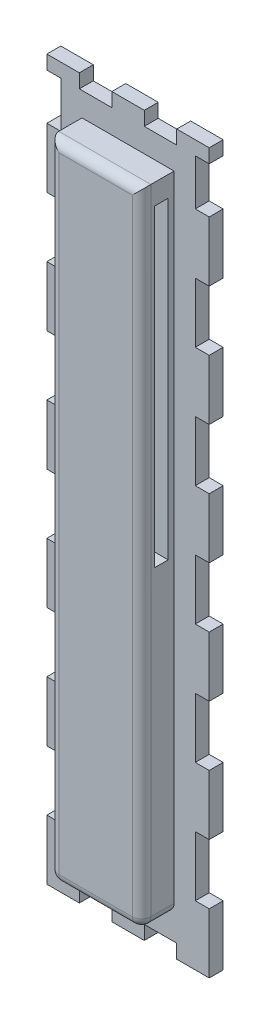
SolidWorks part; units mm, degrees
ref_plane "Front Plane" through (0, 0, 0) normal (0, 0, 1) x (1, 0, 0)
ref_plane "Top Plane" through (0, 0, 0) normal (0, 1, 0) x (1, 0, 0)
ref_plane "Right Plane" through (0, 0, 0) normal (1, 0, 0) x (0, 0, -1)
sketch "Sketch1" plane through (0, 0, 0) normal (0, 0, 1) x (1, 0, 0)
  line L0 (3.5, 74.5) -> (10.5, 74.5)
  line L1 (17.5, 77.5) -> (17.5, -77.5)
  line L2 (-17.5, 77.5) -> (-17.5, -77.5)
  line L3 (-10.5, -74.5) -> (-3.5, -74.5)
  line L4 (-3.5, -74.5) -> (-3.5, -77.5)
  line L5 (-17.5, 77.5) -> (17.5, -77.5) construction
  line L6 (-17.5, -77.5) -> (17.5, 77.5) construction
  line L9 (-17.5, 77.5) -> (-10.5, 77.5)
  line L10 (-10.5, 74.5) -> (-10.5, 77.5)
  line L11 (-3.5, 74.5) -> (-3.5, 77.5)
  line L12 (-3.5, 77.5) -> (3.5, 77.5)
  line L13 (3.5, 74.5) -> (3.5, 77.5)
  line L14 (10.5, 74.5) -> (10.5, 77.5)
  line L15 (10.5, 77.5) -> (17.5, 77.5)
  line L18 (-10.5, 74.5) -> (-3.5, 74.5)
  line L19 (-17.5, 0) -> (17.5, 0) construction
  line L21 (10.5, -77.5) -> (17.5, -77.5)
  line L22 (10.5, -74.5) -> (10.5, -77.5)
  line L23 (3.5, -74.5) -> (10.5, -74.5)
  line L24 (3.5, -74.5) -> (3.5, -77.5)
  line L25 (-3.5, -77.5) -> (3.5, -77.5)
  line L29 (-10.5, -74.5) -> (-10.5, -77.5)
  line L30 (-17.5, -77.5) -> (-10.5, -77.5)
  line L33 (17.5, 74.5) -> (17.5, 77.5)
  point P0 (0, 0)
  dimension "D1" = 155
  dimension "D2" = 35
  dimension "D3" = 7
  dimension "D4" = 3
extrude "Boss-Extrude1" add sketch "Sketch1" along normal blind 3
sketch "Sketch3" plane through (0, 0, 0) normal (0, 0, 1) x (1, 0, 0)
  line L1 (17.5, 77.5) -> (-17.5, 77.5) construction
  line L2 (-14.5, 74.5) -> (-14.5, 64.5833)
  line L3 (-14.5, 64.5833) -> (-17.5, 64.5833)
  line L4 (-17.5, 74.5) -> (-17.5, -77.5) construction
  line L5 (-17.5, 64.5833) -> (-17.5, 51.6667)
  line L6 (-17.5, 51.6667) -> (-14.5, 51.6667)
  line L7 (-14.5, 51.6667) -> (-14.5, 38.75)
  line L8 (-14.5, 38.75) -> (-17.5, 38.75)
  line L9 (-17.5, 38.75) -> (-17.5, 25.8333)
  line L10 (-17.5, 25.8333) -> (-14.5, 25.8333)
  line L11 (-14.5, 25.8333) -> (-14.5, 12.9167)
  line L12 (-14.5, 12.9167) -> (-17.5, 12.9167)
  line L13 (-17.5, 12.9167) -> (-17.5, 0)
  line L14 (-17.5, 0) -> (-14.5, 0)
  line L15 (-14.5, 0) -> (-14.5, -12.9167)
  line L16 (-14.5, -12.9167) -> (-17.5, -12.9167)
  line L17 (-17.5, -12.9167) -> (-17.5, -25.8333)
  line L18 (-17.5, -25.8333) -> (-14.5, -25.8333)
  line L19 (-14.5, -25.8333) -> (-14.5, -38.75)
  line L20 (-14.5, -38.75) -> (-17.5, -38.75)
  line L21 (-17.5, -38.75) -> (-17.5, -51.6667)
  line L22 (-17.5, -51.6667) -> (-14.5, -51.6667)
  line L23 (-14.5, -51.6667) -> (-14.5, -64.5833)
  line L24 (-14.5, -64.5833) -> (-17.5, -64.5833)
  line L25 (-17.5, -64.5833) -> (-17.5, -77.5)
  line L26 (-17.5, -77.5) -> (-14.5, -77.5)
  line L27 (0, 77.5) -> (0, -77.5) construction
  line L28 (-17.5, -77.5) -> (17.5, -77.5) construction
  line L29 (17.5, -77.5) -> (14.5, -77.5)
  line L30 (17.5, -64.5833) -> (17.5, -77.5)
  line L31 (14.5, -64.5833) -> (17.5, -64.5833)
  line L32 (14.5, -51.6667) -> (14.5, -64.5833)
  line L33 (17.5, -51.6667) -> (14.5, -51.6667)
  line L34 (17.5, -38.75) -> (17.5, -51.6667)
  line L35 (14.5, -38.75) -> (17.5, -38.75)
  line L36 (14.5, -25.8333) -> (14.5, -38.75)
  line L37 (17.5, -25.8333) -> (14.5, -25.8333)
  line L38 (17.5, -12.9167) -> (17.5, -25.8333)
  line L39 (14.5, -12.9167) -> (17.5, -12.9167)
  line L40 (14.5, 0) -> (14.5, -12.9167)
  line L41 (17.5, 0) -> (14.5, 0)
  line L42 (17.5, 12.9167) -> (17.5, 0)
  line L43 (14.5, 12.9167) -> (17.5, 12.9167)
  line L44 (14.5, 25.8333) -> (14.5, 12.9167)
  line L45 (17.5, 25.8333) -> (14.5, 25.8333)
  line L46 (17.5, 38.75) -> (17.5, 25.8333)
  line L47 (14.5, 38.75) -> (17.5, 38.75)
  line L48 (14.5, 51.6667) -> (14.5, 38.75)
  line L49 (17.5, 51.6667) -> (14.5, 51.6667)
  line L50 (17.5, 64.5833) -> (17.5, 51.6667)
  line L51 (14.5, 64.5833) -> (17.5, 64.5833)
  line L53 (14.5, 74.5) -> (14.5, 64.5833)
  line L54 (-17.5, 74.5) -> (-17.5, -64.5833)
  line L55 (17.5, -64.5833) -> (17.5, 74.5)
  line L56 (14.5, 74.5) -> (17.5, 74.5)
  line L57 (17.5, 74.5) -> (10.5, 74.5) construction
  line L58 (-17.5, 74.5) -> (-14.5, 74.5)
extrude "Cut-Extrude4" cut sketch "Sketch3" against normal blind 41 and the other way blind 18
sketch "Sketch4" plane through (0, 0, 3) normal (0, 0, 1) x (1, 0, 0)
  line L1 (-6.6939, 66.3161) -> (6.6939, 66.3161)
  line L2 (-6.6939, 66.3161) -> (-6.6939, -66.3161)
  line L3 (-6.6939, -66.3161) -> (6.6939, -66.3161)
  line L4 (6.6939, 66.3161) -> (6.6939, -66.3161)
  line L5 (-6.6939, 66.3161) -> (6.6939, -66.3161) construction
  line L6 (-6.6939, -66.3161) -> (6.6939, 66.3161) construction
  point P0 (0, 0)
extrude "Cut-Extrude5" cut sketch "Sketch4" against normal blind 10
sketch "Sketch5" plane through (0, 0, 3) normal (0, 0, 1) x (1, 0, 0)
  line L1 (-9.9244, 69.3672) -> (9.9244, 69.3672)
  line L2 (-9.9244, 69.3672) -> (-9.9244, -69.3672)
  line L3 (-9.9244, -69.3672) -> (9.9244, -69.3672)
  line L4 (9.9244, 69.3672) -> (9.9244, -69.3672)
  line L5 (-9.9244, 69.3672) -> (9.9244, -69.3672) construction
  line L6 (-9.9244, -69.3672) -> (9.9244, 69.3672) construction
  point P0 (0, 0)
extrude "Boss-Extrude2" add sketch "Sketch5" along normal blind 7
sketch "Sketch8" plane through (9.9244, 0, 0) normal (1, 0, 0) x (0, 0, -1)
  line L1 (-7.2677, 64.9306) -> (-4.2677, 64.9306)
  line L2 (-7.2677, 64.9306) -> (-7.2677, -2.5855)
  line L3 (-7.2677, -2.5855) -> (-4.2677, -2.5855)
  line L4 (-4.2677, 64.9306) -> (-4.2677, -2.5855)
  dimension "D1" = 3
  dimension "D2" = 67.5161
extrude "Cut-Extrude6" cut sketch "Sketch8" against normal blind 5
sketch "Sketch9" plane through (0, 0, 3) normal (0, 0, -1) x (-1, 0, 0)
  line L1 (-6.6939, 66.3161) -> (6.6939, 66.3161)
  line L2 (-6.6939, 66.3161) -> (-6.6939, -66.3161)
  line L3 (-6.6939, -66.3161) -> (6.6939, -66.3161)
  line L4 (6.6939, 66.3161) -> (6.6939, -66.3161)
  line L5 (-6.6939, 66.3161) -> (6.6939, -66.3161) construction
  line L6 (-6.6939, -66.3161) -> (6.6939, 66.3161) construction
  point P0 (0, 0)
extrude "Cut-Extrude7" cut sketch "Sketch9" against normal blind 5
fillet "Fillet1" radius 2 6 edges at (0, 69.3672, 10) (9.9244, 0, 10) (9.9244, -69.3672, 6.5) (0, -69.3672, 10) (-9.9244, -69.3672, 6.5) (-9.9244, 0, 10)
sketch "Sketch10" plane through (6.6939, 0, 0) normal (-1, 0, 0) x (0, 0, 1)
  circle A0 centre (1.6566, -64.1203) radius 1
  circle A1 centre (1.6566, -49.1203) radius 1
  circle A2 centre (1.6566, -34.1203) radius 1
  circle A3 centre (1.6566, -19.1203) radius 1
  circle A4 centre (1.6566, -4.1203) radius 1
  circle A5 centre (1.6566, 10.8797) radius 1
  circle A6 centre (1.6566, 25.8797) radius 1
  circle A7 centre (1.6566, 40.8797) radius 1
  circle A8 centre (1.6566, 55.8797) radius 1
  dimension "D1" = 2
  dimension "D2" = 9
extrude "Boss-Extrude3" add sketch "Sketch10" along normal blind 14
equation "\"Thickness of material\"= 3mm"
equation "\"Length of box\"= 155mm"
equation "\"width of box\"= 55mm"
equation "\"D1@Boss-Extrude1\"=\"Thickness of material\""
equation "\"D8@Sketch3\"=\"Length of box\"/12"
equation "\"D2@Sketch3\"=\"Length of box\"/12"
equation "\"D9@Sketch3\"=\"Length of box\"/12"
equation "\"D3@Sketch3\"=\"Length of box\"/12"
equation "\"D10@Sketch3\"=\"Length of box\"/12"
equation "\"D4@Sketch3\"=\"Length of box\"/12"
equation "\"D11@Sketch3\"=\"Length of box\"/12"
equation "\"D5@Sketch3\"=\"Length of box\"/12"
equation "\"D12@Sketch3\"=\"Length of box\"/12"
equation "\"D6@Sketch3\"=\"Length of box\"/12"
equation "\"D13@Sketch3\"=\"Length of box\"/12"
equation "\"D7@Sketch3\"=\"Thickness of material\""
equation "\"D14@Sketch3\"=\"Thickness of material\""
equation "\"D15@Sketch3\"=\"Thickness of material\""
equation "\"D16@Sketch3\"=\"Thickness of material\""
equation "\"D17@Sketch3\"=\"Thickness of material\""
equation "\"D18@Sketch3\"=\"Thickness of material\""
equation "\"D19@Sketch3\"=\"Thickness of material\""
